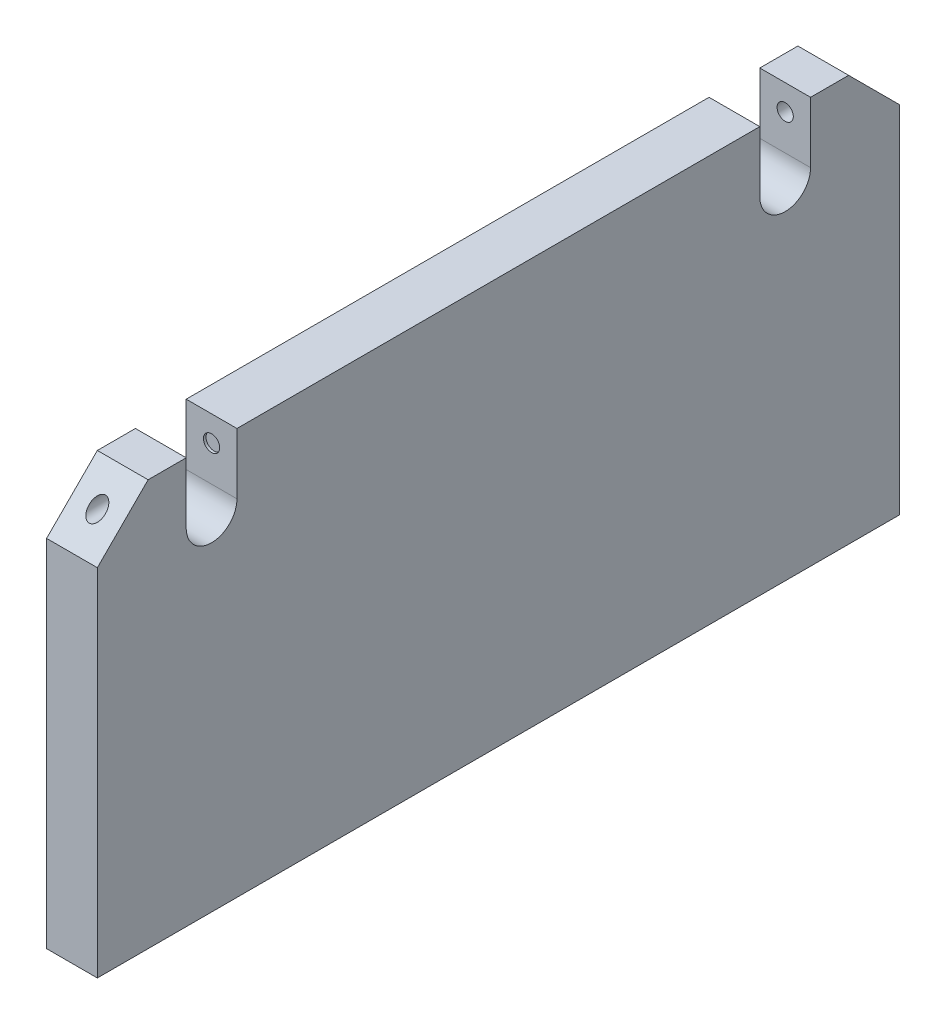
SolidWorks part; units mm, degrees
ref_plane "Face" through (0, 0, 0) normal (0, 0, 1) x (1, 0, 0)
ref_plane "Dessus" through (0, 0, 0) normal (0, 1, 0) x (1, 0, 0)
ref_plane "Droite" through (0, 0, 0) normal (1, 0, 0) x (0, 0, -1)
sketch "Esquisse1" plane through (0, 0, 0) normal (1, 0, 0) x (0, 0, -1)
  line L0 (0, 0) -> (158, 0)
  line L1 (0, 0) -> (0, 80)
  line L2 (158, 80) -> (0, 80)
  line L3 (158, 80) -> (158, 0)
  dimension "D1" = 158
  dimension "D2" = 80
extrude "Base-Extrusion" add sketch "Esquisse1" along normal blind 10
sketch "Esquisse5" plane through (0, 0, 0) normal (0, -1, 0) x (1, 0, 0)
  line L0 (5, 10) -> (5, -190.1105) construction
  line L1 (0, 0) -> (0, -158) construction
  circle A0 centre (5, -24) radius 2.1
  circle A1 centre (5, -134) radius 2.1
  dimension "D2" = 4.2
  dimension "D1" = 5
  dimension "D5" = 24
  dimension "D6" = 110
extrude "Enlèv. mat.-Extru.3" cut sketch "Esquisse5" against normal blind 15
chamfer "Chanfrein4" distance 10 angle 45
sketch "Esquisse9" plane through (0, 0, 0) normal (0, 0, 1) x (1, 0, 0)
  line L0 (5, 80.0636) -> (5, 54.3438) construction
  line L1 (5, 15) -> (5, 0) construction
  line L2 (0, 80) -> (10, 80) construction
  circle A0 centre (5, 75) radius 1.6
  dimension "D2" = 3.2
  dimension "D1" = 5
extrude "Enlèv. mat.-Extru.7" cut sketch "Esquisse9" against normal blind 28
sketch "Esquisse10" plane through (0, 0, -158) normal (0, 0, -1) x (-1, 0, 0)
  line L0 (-5, 15) -> (-5, 0) construction
  line L1 (-5, 80.0764) -> (-5, 9.3148) construction
  line L2 (-10, 80) -> (0, 80) construction
  circle A0 centre (-5, 75) radius 1.6
  dimension "D2" = 3.2
  dimension "D1" = 5
extrude "Enlèv. mat.-Extru.8" cut sketch "Esquisse10" against normal blind 28
sketch "Esquisse11" plane through (10, 0, 0) normal (1, 0, 0) x (0, 0, -1)
  line L0 (148, 80) -> (10, 80) construction
  line L1 (0, 0) -> (0, 70) construction
  line L2 (11.3909, 68) -> (145.206, 68) construction
  line L4 (17.5, 68) -> (17.5, 83.4943)
  line L5 (17.5, 83.4943) -> (27.5, 83.4943)
  line L6 (27.5, 68) -> (27.5, 83.4943)
  line L8 (130.5, 68) -> (130.5, 86.3004)
  line L9 (130.5, 86.3004) -> (140.5, 86.3004)
  line L10 (140.5, 68) -> (140.5, 86.3004)
  line L11 (31.3177, 68) -> (14.7146, 68) construction
  arc A0 (17.5, 68) -> (27.5, 68) centre (22.5, 68) ccw
  arc A1 (130.5, 68) -> (140.5, 68) centre (135.5, 68) ccw
  dimension "D1" = 10
  dimension "D3" = 10
  dimension "D2" = 12
  dimension "D5" = 113
  dimension "D6" = 22.5
extrude "Enlèv. mat.-Extru.9" cut sketch "Esquisse11" against normal through all
